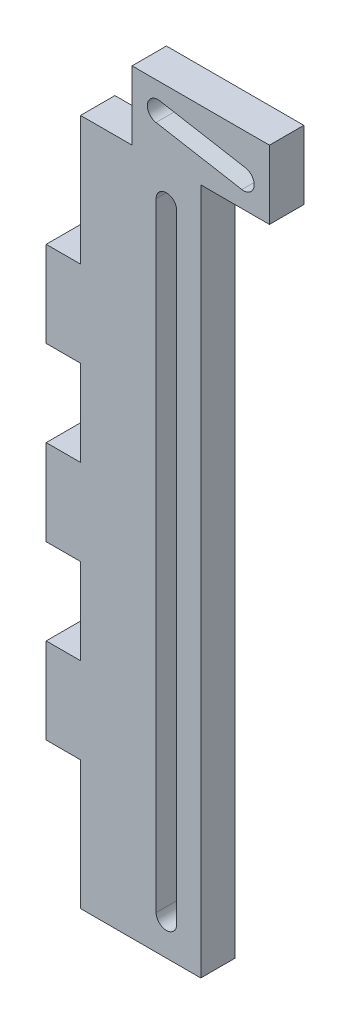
SolidWorks part; units mm, degrees
ref_plane "Front Plane" through (0, 0, 0) normal (0, 0, 1) x (1, 0, 0)
ref_plane "Top Plane" through (0, 0, 0) normal (0, 1, 0) x (1, 0, 0)
ref_plane "Right Plane" through (0, 0, 0) normal (1, 0, 0) x (0, 0, -1)
sketch "Sketch2" plane through (0, 0, 0) normal (0, 0, 1) x (1, 0, 0)
  line L0 (5, 38) -> (5, 2) construction
  line L1 (0, 0) -> (7, 0)
  line L2 (0, 0) -> (0, 7.5)
  line L3 (0, 40) -> (3, 40)
  line L4 (7, 0) -> (7, 40)
  line L5 (5.6, 38) -> (5.6, 2)
  line L6 (4.4, 38) -> (4.4, 2)
  line L7 (0, 17.5) -> (0, 22.5) construction
  line L8 (0, 22.5) -> (-2, 22.5)
  line L9 (0, 22.5) -> (0, 17.5) construction
  line L10 (0, 17.5) -> (-2, 17.5)
  line L11 (-2, 22.5) -> (-2, 17.5)
  line L12 (0, 22.5) -> (0, 27.5)
  line L13 (0, 32.5) -> (-2, 32.5)
  line L14 (-2, 32.5) -> (-2, 27.5)
  line L15 (0, 27.5) -> (-2, 27.5)
  line L16 (0, 22.5) -> (-2, 22.5)
  line L17 (-2, 22.5) -> (-2, 17.5)
  line L18 (0, 17.5) -> (-2, 17.5)
  line L19 (0, 12.5) -> (-2, 12.5)
  line L20 (-2, 12.5) -> (-2, 7.5)
  line L21 (0, 7.5) -> (-2, 7.5)
  line L22 (0, 27.5) -> (0, 32.5) construction
  line L23 (0, 32.5) -> (0, 40)
  line L24 (0, 7.5) -> (0, 12.5) construction
  line L25 (0, 12.5) -> (0, 17.5)
  line L26 (3, 40) -> (7, 40) construction
  line L27 (7, 40) -> (3, 40) construction
  line L30 (3, 40) -> (3, 44)
  line L34 (11, 44) -> (11, 40)
  line L37 (0, 22.5) -> (0, 12.5) construction
  line L38 (11, 40) -> (7, 40)
  line L39 (3, 44) -> (11, 44)
  line L40 (4.5, 42.4408) -> (9.5, 41.5592) construction
  line L41 (4.6059, 43.0416) -> (9.6059, 42.1599)
  line L42 (4.3941, 41.8401) -> (9.3941, 40.9584)
  arc A0 (5.6, 38) -> (4.4, 38) centre (5, 38) ccw
  arc A1 (4.4, 2) -> (5.6, 2) centre (5, 2) ccw
  arc A2 (4.6059, 43.0416) -> (4.3941, 41.8401) centre (4.5, 42.4408) ccw
  arc A3 (9.3941, 40.9584) -> (9.6059, 42.1599) centre (9.5, 41.5592) ccw
  point P7 (5, 20)
  point P18 (7, 20)
  point P19 (-2, 20)
  point P36 (7, 42)
  point P41 (3, 42)
  point P42 (7, 44)
extrude "Boss-Extrude1" add sketch "Sketch2" along normal blind 2 contours L25 L19 L20 L21 L2 L1 L4 L3 L23 L13 L14 L15 L12 L8 L11 L10 A1 L6 A0 L5
equation "\"thkness\"= 2mm"
equation "\"size\"= 65mm"
equation "\"D7@Sketch2\"=\"thkness\""
equation "\"D1@Boss-Extrude1\"=\"thkness\""
equation "\"side_len\"= \"size\" / (2 * sin ( 60 ) )"
equation "\"height\"= 50mm"
equation "\"D2@Sketch2\"=\"height\"-10"
